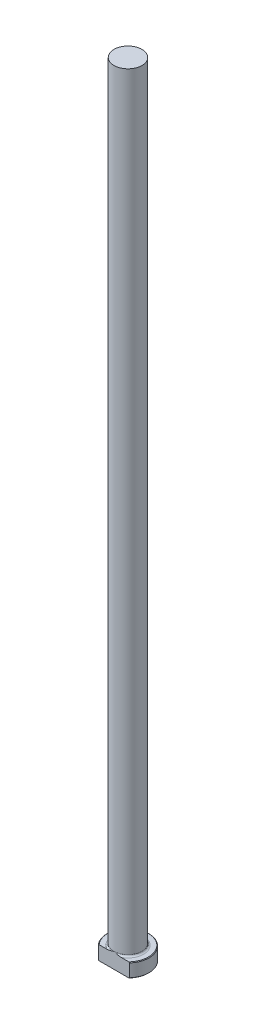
SolidWorks part; units mm, degrees
ref_plane "Front Plane" through (0, 0, 0) normal (0, 0, 1) x (1, 0, 0)
ref_plane "Top Plane" through (0, 0, 0) normal (0, 1, 0) x (1, 0, 0)
ref_plane "Right Plane" through (0, 0, 0) normal (1, 0, 0) x (0, 0, -1)
sketch "Sketch1" plane through (0, 0, 0) normal (0, 0, 1) x (1, 0, 0)
  line L0 (0, 259.9588) -> (0, -15.1925) construction
  line L1 (0, 0) -> (-9.525, 0)
  line L2 (-9.525, 0) -> (-9.525, 6.35)
  line L3 (-9.525, 6.35) -> (-6.35, 6.35)
  line L4 (-6.35, 6.35) -> (-6.35, 355.6)
  line L5 (-6.35, 355.6) -> (0, 355.6)
  line L6 (0, 355.6) -> (0, 0)
  dimension "L" = 355.6
  dimension "H" = 19.05
  dimension "T" = 6.35
  dimension "D" = 12.7
revolve "Revolve1" add sketch "Sketch1" angle 360 about L0
chamfer "Chamfer1" distance 0.254 angle 45 2 edges at (0, 6.35, 9.525) (0, 0, 9.525)
fillet "Fillet1" radius 0.762 1 edges at (0, 6.35, 6.35)
sketch "Sketch2" plane through (0, 0, 0) normal (0, 1, 0) x (1, 0, 0)
  line L0 (-7.0995, -6.35) -> (7.0995, -6.35)
  circle A0 centre (0, 0) radius 9.525 construction
  arc A1 (-7.0995, -6.35) -> (7.0995, -6.35) centre (0, 0) ccw
  circle A3 centre (0, 0) radius 6.35 construction
  dimension "D1" = 0
extrude "Key" cut sketch "Sketch2" along normal through all
sketch "Pocket Sketch" plane through (0, 0, 0) normal (0, 0, 1) x (1, 0, 0)
  line L0 (-9.9219, 0) -> (-9.9219, 6.3754)
  line L1 (-9.9219, 6.3754) -> (-7.5089, 6.3754)
  line L2 (-6.7469, 7.1374) -> (-6.7469, 22.225)
  line L3 (-6.7469, 22.225) -> (0, 22.225)
  line L4 (0, 22.225) -> (0, 0)
  line L5 (0, 0) -> (-9.9219, 0)
  line L6 (0, 12.6104) -> (0, -2.4989) construction
  line L7 (-9.525, 6.096) -> (-9.525, 0.254) construction
  line L8 (9.271, 6.35) -> (-9.271, 6.35) construction
  line L9 (-6.35, 355.6) -> (-6.35, 7.112) construction
  line L10 (-7.5089, 6.3754) -> (-6.7469, 7.1374)
  point P3 (-6.7469, 6.3754)
  dimension "D1" = 19.8437
  dimension "D2" = 0.3969
  dimension "D3" = 0.0254
  dimension "D4" = 0.3969
  dimension "D5" = 13.4937
  dimension "D6" = 22.225
